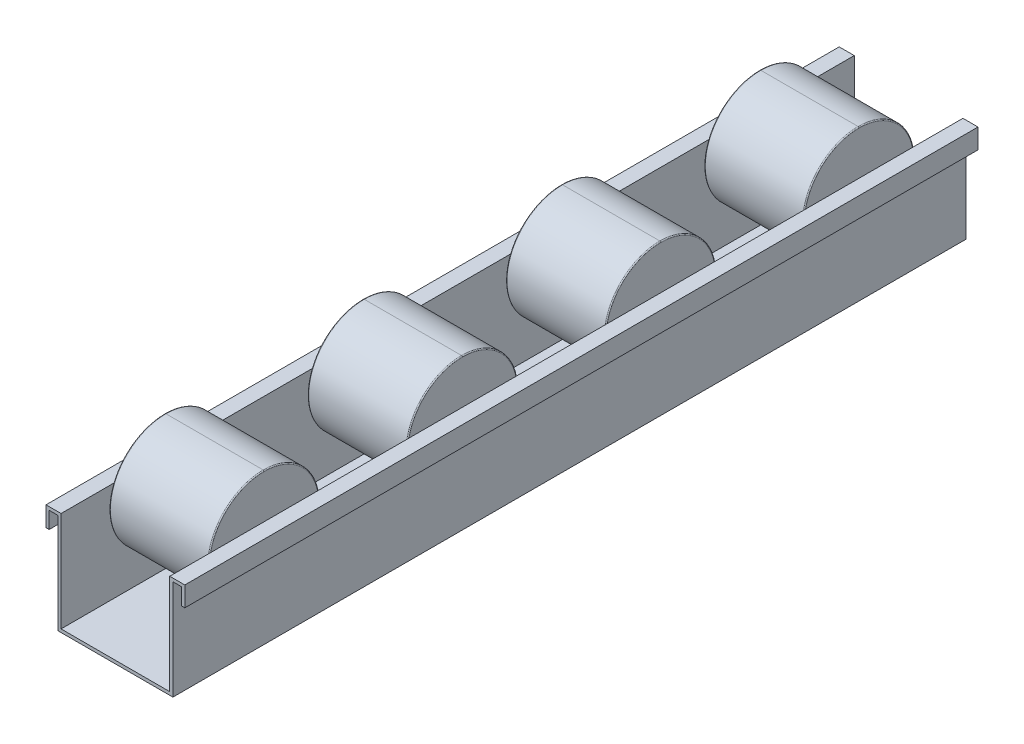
SolidWorks part; units mm, degrees
ref_plane "Front Plane" through (0, 0, 0) normal (0, 0, 1) x (1, 0, 0)
ref_plane "Top Plane" through (0, 0, 0) normal (0, 1, 0) x (1, 0, 0)
ref_plane "Right Plane" through (0, 0, 0) normal (1, 0, 0) x (0, 0, -1)
imported_body "1.8054 Rullakisko ESD.STEP<1>"
move or copy body "Body-Move/Copy1" bodies to move or copy 105 104 103 101 102 copy no rotation origin (0, 100, 13) rotation axis (-1, 0, 0) rotation angle 90
